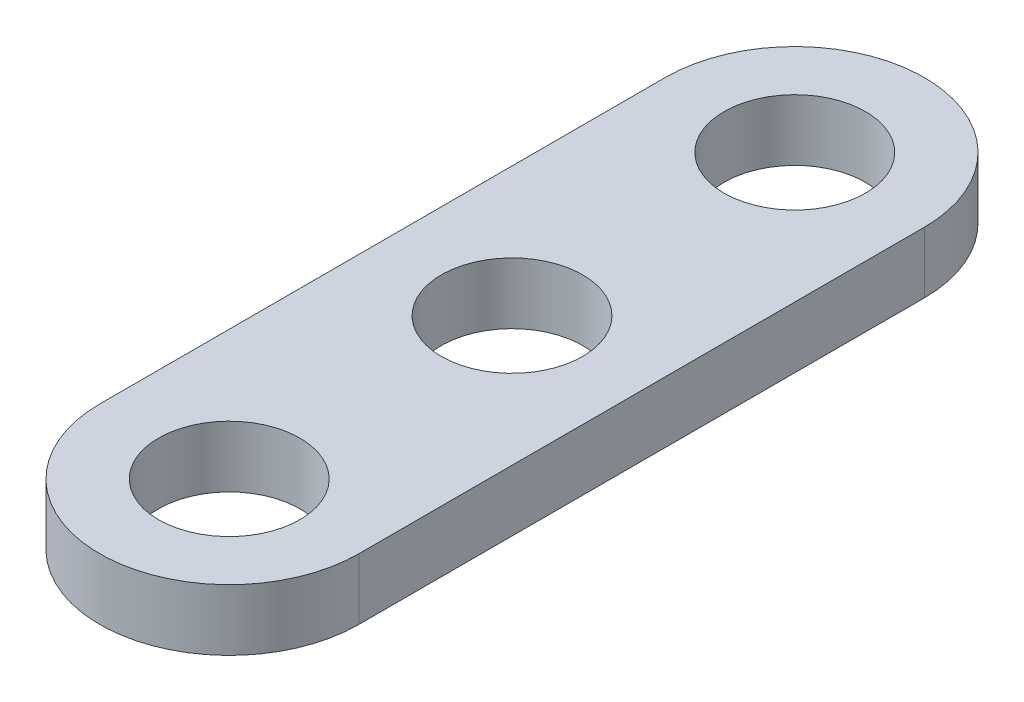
SolidWorks part; units mm, degrees
ref_plane "前视基准面" through (0, 0, 0) normal (0, 0, 1) x (1, 0, 0)
ref_plane "上视基准面" through (0, 0, 0) normal (0, 1, 0) x (1, 0, 0)
ref_plane "右视基准面" through (0, 0, 0) normal (1, 0, 0) x (0, 0, -1)
other "Configuration Table"
sketch "草图1" plane through (0, 0, 0) normal (0, 1, 0) x (1, 0, 0)
  line L0 (75.5089, 0) -> (-75.5089, 0) construction
  line L1 (0, -97.3183) -> (0, 97.3183) construction
  line L4 (-5.5, -12) -> (-5.5, 12)
  line L5 (5.5, -12) -> (5.5, 12)
  arc A0 (-5.5, -12) -> (5.5, -12) centre (0, -12) ccw
  arc A2 (-5.5, 12) -> (5.5, 12) centre (0, 12) cw
  circle A3 centre (0, 12) radius 3
  circle A4 centre (0, 0) radius 3
  circle A5 centre (0, -12) radius 3
  point P3 (0, 0)
  point P7 (0, 0)
  point P10 (-5.5, 0)
  point P12 (5.5, 0)
  dimension "D1" = 5.5
  dimension "D2" = 24
  dimension "D3" = 6
  dimension "D4" = 6
  dimension "D5" = 6
extrude "凸台-拉伸1" add sketch "草图1" along normal blind 2.6
